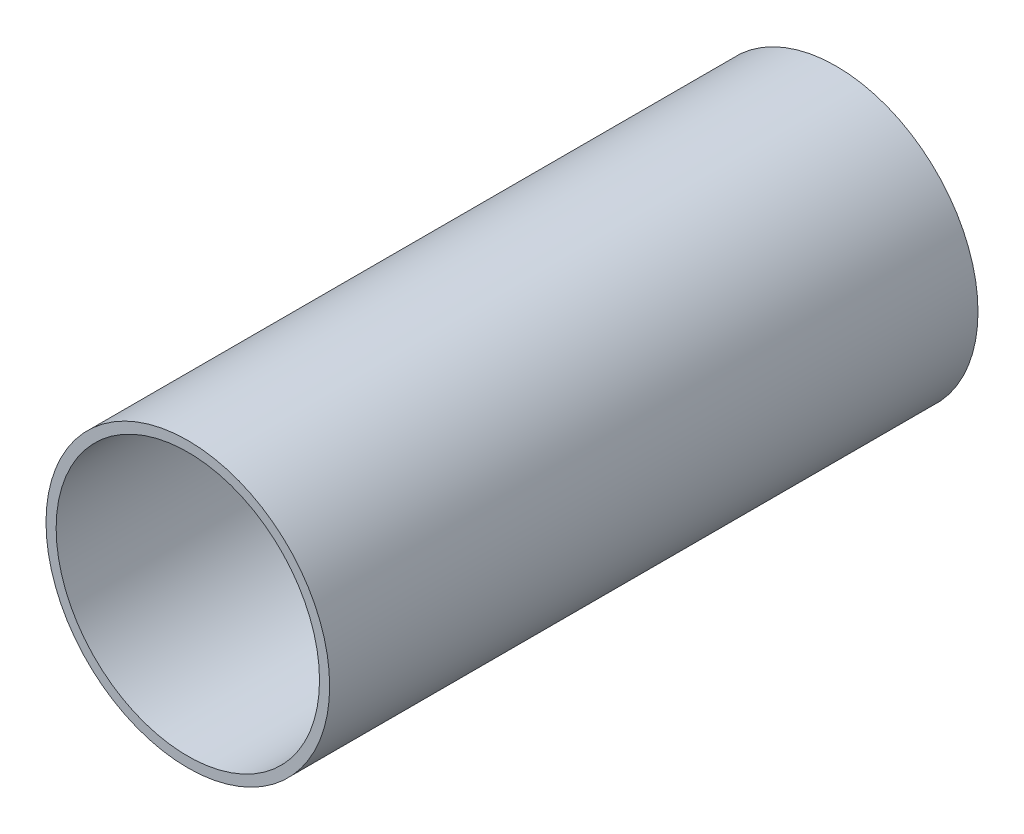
SolidWorks part; units mm, degrees
ref_plane "Front Plane" through (0, 0, 0) normal (0, 0, 1) x (1, 0, 0)
ref_plane "Top Plane" through (0, 0, 0) normal (0, 1, 0) x (1, 0, 0)
ref_plane "Right Plane" through (0, 0, 0) normal (1, 0, 0) x (0, 0, -1)
sketch "Sketch1" plane through (0, 0, 0) normal (0, 0, 1) x (1, 0, 0)
  circle A0 centre (0, 0) radius 22.225
  circle A1 centre (0, 0) radius 20.6375
  dimension "D1" = 44.45
  dimension "D2" = 41.275
extrude "Extrude1" add sketch "Sketch1" along normal blind 101.6
